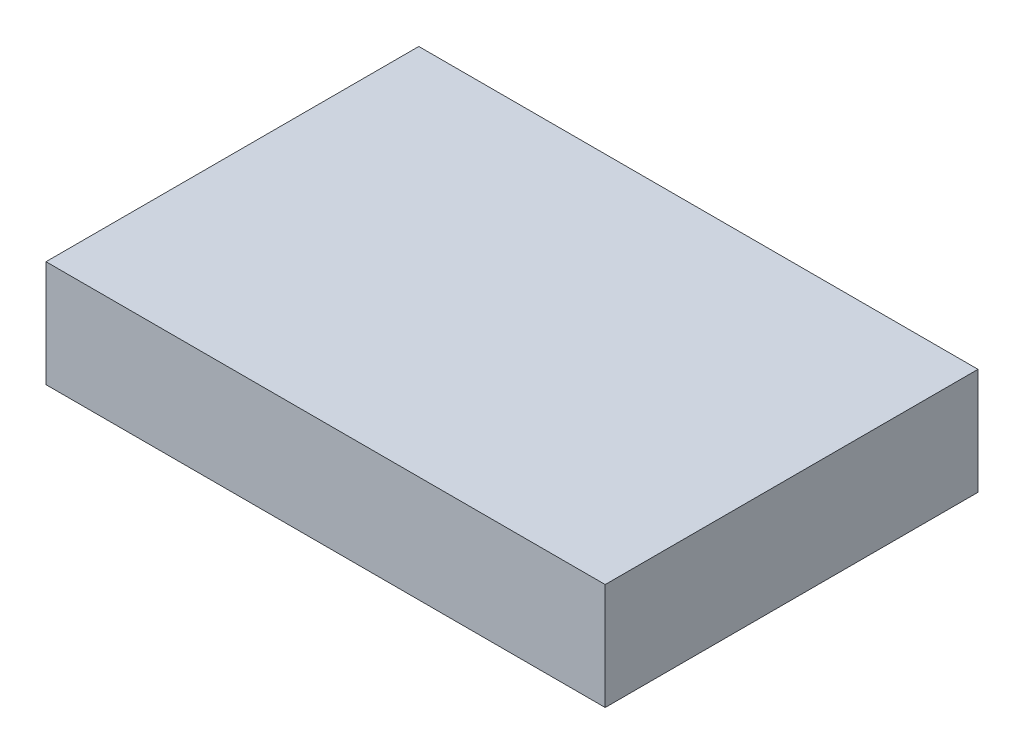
SolidWorks part; units mm, degrees
ref_plane "前视基准面" through (0, 0, 0) normal (0, 0, 1) x (1, 0, 0)
ref_plane "上视基准面" through (0, 0, 0) normal (0, 1, 0) x (1, 0, 0)
ref_plane "右视基准面" through (0, 0, 0) normal (1, 0, 0) x (0, 0, -1)
sketch "草图1" plane through (0, 0, 0) normal (0, 1, 0) x (1, 0, 0)
  line L1 (-63, 42) -> (63, 42)
  line L2 (-63, 42) -> (-63, -42)
  line L3 (-63, -42) -> (63, -42)
  line L4 (63, 42) -> (63, -42)
  line L5 (-63, 42) -> (63, -42) construction
  line L6 (-63, -42) -> (63, 42) construction
  point P1 (0, 0)
  dimension "D1" = 126
  dimension "D2" = 84
extrude "凸台-拉伸1" add sketch "草图1" along normal blind 24
